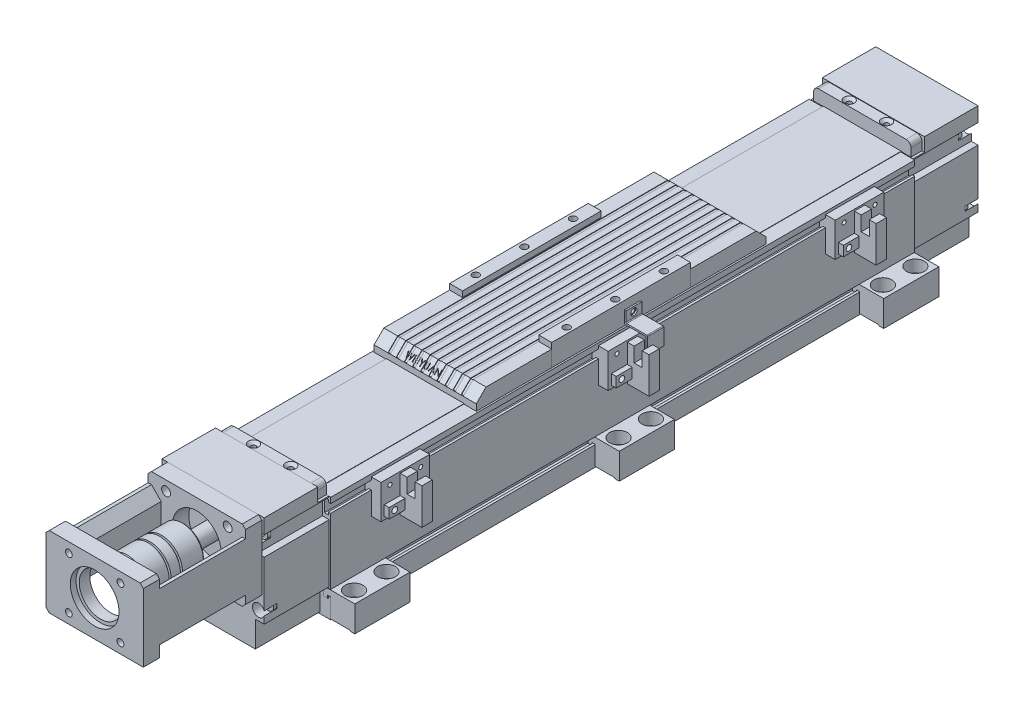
SolidWorks part; units mm, degrees
other "<光电感应片>-<切除-拉伸1>"
other "<EE-SX672672P>-<凸台-拉伸3>"
other "<EE-SX672672P>-<凸台-拉伸3>"
other "<EE-SX672672P>-<凸台-拉伸3>"
other "<MSX65B-50 100W松下伺服电机座>-<Ø5.5 (5.5) 直径孔1>"
ref_plane "前视基准面" through (0, 0, 0) normal (0, 0, 1) x (1, 0, 0)
ref_plane "上视基准面" through (0, 0, 0) normal (0, 1, 0) x (1, 0, 0)
ref_plane "右视基准面" through (0, 0, 0) normal (1, 0, 0) x (0, 0, -1)
sketch "草图1" plane through (0, 0, 0) normal (0, 0, 1) x (1, 0, 0)
  line L0 (-70.2256, 0) -> (70.2256, 0) construction
  line L1 (0, -59.1882) -> (0, 59.1882) construction
  line L2 (-32.5, -32.75) -> (-32.5, -20.65)
  line L3 (-32.5, 32.75) -> (-22.4, 32.75)
  line L4 (-32.5, -32.75) -> (32.5, -32.75)
  line L5 (32.5, 29.35) -> (32.5, 32.75)
  line L6 (-22.4, 32.75) -> (-22.4, 29.75)
  line L7 (-22.4, 29.75) -> (-19.4, 29.75)
  line L8 (-19.4, 29.75) -> (-19.4, 32.75)
  line L9 (-17.9, 26.75) -> (17.9, 26.75)
  line L11 (17.9, 32.75) -> (17.9, 26.75)
  line L12 (19.4, 32.75) -> (17.9, 32.75)
  line L13 (-19.4, 32.75) -> (-17.9, 32.75)
  line L14 (-17.9, 32.75) -> (-17.9, 26.75)
  line L18 (19.4, 29.75) -> (19.4, 32.75)
  line L19 (22.4, 29.75) -> (19.4, 29.75)
  line L20 (22.4, 32.75) -> (22.4, 29.75)
  line L21 (32.5, 32.75) -> (22.4, 32.75)
  line L22 (-32.5, -20.65) -> (-31, -20.65)
  line L23 (-31, -20.65) -> (-31, -22.15)
  line L24 (-31, -22.15) -> (-28, -22.15)
  line L25 (-28, -22.15) -> (-28, -14.95)
  line L26 (-28, -14.95) -> (-31, -14.95)
  line L27 (-32.5, 29.35) -> (-31, 29.35)
  line L28 (-31, 29.35) -> (-31, 30.85)
  line L29 (-31, 30.85) -> (-28.7, 30.85)
  line L30 (-28.7, 30.85) -> (-28.7, 22.65)
  line L31 (-28.7, 22.65) -> (-31, 22.65)
  line L32 (-32.5, -16.45) -> (-32.5, 24.15)
  line L33 (-32.5, 29.35) -> (-32.5, 32.75)
  line L34 (32.5, -16.45) -> (32.5, 24.15)
  line L35 (28.7, 26.75) -> (33.4434, 26.75) construction
  line L36 (32.5, 24.15) -> (31, 24.15)
  line L37 (31, 24.15) -> (31, 22.65)
  line L38 (28.7, 22.65) -> (31, 22.65)
  line L39 (28.7, 30.85) -> (28.7, 22.65)
  line L40 (28, -18.55) -> (34.4226, -18.55) construction
  line L41 (32.5, -16.45) -> (31, -16.45)
  line L42 (31, -16.45) -> (31, -14.95)
  line L43 (28, -14.95) -> (31, -14.95)
  line L44 (28, -22.15) -> (28, -14.95)
  line L45 (32.5, -32.75) -> (32.5, -20.65)
  line L50 (-28.7, 26.75) -> (-33.4434, 26.75) construction
  line L51 (-31, 24.15) -> (-31, 22.65)
  line L52 (-32.5, 24.15) -> (-31, 24.15)
  line L53 (31, 30.85) -> (28.7, 30.85)
  line L54 (31, 29.35) -> (31, 30.85)
  line L55 (32.5, 29.35) -> (31, 29.35)
  line L56 (-28, -18.55) -> (-34.4226, -18.55) construction
  line L57 (-31, -16.45) -> (-31, -14.95)
  line L58 (-32.5, -16.45) -> (-31, -16.45)
  line L59 (31, -22.15) -> (28, -22.15)
  line L60 (31, -20.65) -> (31, -22.15)
  line L61 (32.5, -20.65) -> (31, -20.65)
  circle A0 centre (-24.37, 26.75) radius 1.7
  circle A1 centre (-28, -9.75) radius 1.7
  circle A2 centre (24.37, 26.75) radius 1.7
  circle A3 centre (28, -9.75) radius 1.7
  point P6 (0, 0)
  point P9 (22.5, 0)
  point P11 (-22.5, 0)
  point P12 (0, -32.75)
  point P67 (20, 0)
  point P68 (-20, 0)
  dimension "D10" = 3.4
  dimension "D11" = 3.4
  dimension "D1" = 65
  dimension "D2" = 65.5
  dimension "D3" = 1.5
  dimension "D4" = 3
  dimension "D5" = 3
  dimension "D6" = 35.8
  dimension "D12" = 6
  dimension "D13" = 23
  dimension "D14" = 12.1
  dimension "D15" = 1.5
  dimension "D16" = 3
  dimension "D17" = 1.5
  dimension "D18" = 7.2
  dimension "D19" = 3.4
  dimension "D20" = 1.5
  dimension "D21" = 1.5
  dimension "D22" = 2.3
  dimension "D23" = 8.2
  dimension "D24" = 48.74
  dimension "D25" = 56
  dimension "D28" = 6
extrude "拉伸1" add sketch "草图1" along normal blind 360
sketch "草图2" plane through (0, 0, 360) normal (0, 0, 1) x (1, 0, 0)
  line L0 (-24.37, 26.75) -> (24.37, 26.75) construction
  line L1 (-28, -9.75) -> (28, -9.75) construction
  line L2 (0, 26.75) -> (0, 0) construction
  line L3 (-31.5, -15.55) -> (-26, -15.55)
  line L4 (31.5, 41.25) -> (-31.5, 41.25)
  line L5 (-31.5, 41.25) -> (-31.5, 32.25)
  line L6 (-31.5, 32.25) -> (-27.37, 32.25)
  line L7 (-27.37, 32.25) -> (-27.37, 20.25)
  line L8 (-27.37, 20.25) -> (-31.5, 20.25)
  line L9 (-31.5, 20.25) -> (-31.5, -15.55)
  line L10 (-26, -15.55) -> (-26, -31.55)
  line L11 (26, -15.55) -> (26, -31.55)
  line L12 (31.5, -15.55) -> (26, -15.55)
  line L13 (-26, -31.55) -> (26, -31.55)
  line L18 (31.5, 20.25) -> (31.5, -15.55)
  line L19 (27.37, 20.25) -> (31.5, 20.25)
  line L20 (27.37, 32.25) -> (27.37, 20.25)
  line L21 (31.5, 32.25) -> (27.37, 32.25)
  line L22 (31.5, 41.25) -> (31.5, 32.25)
  circle A0 centre (-24.37, 26.75) radius 1.7
  circle A1 centre (-28, -9.75) radius 1.7
  circle A2 centre (24.37, 26.75) radius 1.7
  circle A3 centre (28, -9.75) radius 1.7
  point P18 (0, -21.8)
  dimension "D1" = 5.8
  dimension "D3" = 63
  dimension "D4" = 3
  dimension "D5" = 52
  dimension "D7" = 9
  dimension "D8" = 12
  dimension "D2" = 72.8
extrude "拉伸2" add sketch "草图2" along normal blind 40
sketch "草图3" plane through (0, 0, 400) normal (0, 0, 1) x (1, 0, 0)
  line L0 (0, 0) -> (0, 30.1742) construction
  circle A0 centre (-24.37, 26.75) radius 3.75
  circle A1 centre (-28, -9.75) radius 3.75
  circle A2 centre (24.37, 26.75) radius 3.75
  circle A3 centre (28, -9.75) radius 3.75
  dimension "D1" = 7.5
  dimension "D2" = 7.5
extrude "拉伸3" cut sketch "草图3" against normal blind 8
sketch "草图5" plane through (0, 0, 392) normal (0, 0, 1) x (1, 0, 0)
  line L0 (0, 0) -> (0, 9.7659) construction
  line L1 (28.866, -8.25) -> (29.7321, -9.75)
  line L2 (-22.6379, 26.75) -> (-23.504, 28.25)
  line L3 (-23.504, 28.25) -> (-25.236, 28.25)
  line L4 (-25.236, 28.25) -> (-26.1021, 26.75)
  line L5 (-26.1021, 26.75) -> (-25.236, 25.25)
  line L6 (-25.236, 25.25) -> (-23.504, 25.25)
  line L7 (-23.504, 25.25) -> (-22.6379, 26.75)
  line L8 (-29.7321, -9.75) -> (-28.866, -11.25)
  line L9 (-28.866, -11.25) -> (-27.134, -11.25)
  line L10 (-27.134, -11.25) -> (-26.2679, -9.75)
  line L11 (-26.2679, -9.75) -> (-27.134, -8.25)
  line L12 (-27.134, -8.25) -> (-28.866, -8.25)
  line L13 (-28.866, -8.25) -> (-29.7321, -9.75)
  line L14 (27.134, -8.25) -> (28.866, -8.25)
  line L15 (26.2679, -9.75) -> (27.134, -8.25)
  line L16 (27.134, -11.25) -> (26.2679, -9.75)
  line L17 (28.866, -11.25) -> (27.134, -11.25)
  line L18 (29.7321, -9.75) -> (28.866, -11.25)
  line L19 (23.504, 25.25) -> (22.6379, 26.75)
  line L20 (25.236, 25.25) -> (23.504, 25.25)
  line L21 (26.1021, 26.75) -> (25.236, 25.25)
  line L22 (25.236, 28.25) -> (26.1021, 26.75)
  line L23 (23.504, 28.25) -> (25.236, 28.25)
  line L24 (22.6379, 26.75) -> (23.504, 28.25)
  circle A0 centre (-24.37, 26.75) radius 3.25
  circle A1 centre (-24.37, 26.75) radius 1.5 construction
  circle A2 centre (-28, -9.75) radius 3.25
  circle A3 centre (-28, -9.75) radius 1.5 construction
  circle A4 centre (28, -9.75) radius 1.5 construction
  circle A5 centre (24.37, 26.75) radius 1.5 construction
  circle A6 centre (28, -9.75) radius 3.25
  circle A7 centre (24.37, 26.75) radius 3.25
  dimension "D1" = 6.5
  dimension "D2" = 3
  dimension "D3" = 6.5
  dimension "D4" = 3
extrude "拉伸4" add sketch "草图5" along normal blind 2
sketch "草图6" plane through (0, 41.25, 0) normal (0, 1, 0) x (1, 0, 0)
  line L0 (31.5, -400) -> (31.5, -360) construction
  line L1 (-31.5, -360) -> (31.5, -360)
  line L2 (-31.5, -360) -> (-31.5, -367)
  line L3 (-31.5, -367) -> (31.5, -367)
  line L4 (31.5, -360) -> (31.5, -367)
  dimension "D1" = 7
extrude "拉伸5" cut sketch "草图6" against normal blind 8.3
sketch "草图7" plane through (0, -32.75, 0) normal (0, -1, 0) x (1, 0, 0)
  line L0 (0, 0) -> (0, 360) construction
  line L1 (-32.5, 360) -> (32.5, 360) construction
  point P5 (0, 180)
ref_plane "基准面1" through (0, 0, 180) normal (0, 0, 1) x (1, 0, 0)
mirror "镜向2" about plane through (0, 0, 180) normal (0, 0, 1)
sketch "草图8" plane through (0, 32.95, 0) normal (0, 1, 0) x (1, 0, 0)
  line L0 (0, 7) -> (0, -8.336) construction
  line L1 (-31.5, 7) -> (31.5, 7) construction
  line L2 (-24, 7) -> (-24, -367)
  line L3 (-31.5, -367) -> (31.5, -367) construction
  line L4 (24, 7) -> (24, -367)
  line L5 (-24, 7) -> (24, 7)
  line L6 (-24, -367) -> (24, -367)
  dimension "D1" = 48
extrude "拉伸6" add sketch "草图8" along normal blind 0.2
sketch "草图9" plane through (0, 32.95, 0) normal (0, 1, 0) x (1, 0, 0)
  line L0 (0, 0) -> (0, 7) construction
  line L1 (32.5, 0) -> (31.5, 0) construction
  line L2 (-31.5, 7) -> (31.5, 7) construction
  line L4 (-30, 7) -> (-30, 0.2)
  line L6 (-30, 0.2) -> (30, 0.2)
  line L7 (-30, 7) -> (30, 7)
  line L9 (30, 7) -> (30, 0.2)
  dimension "D1" = 60
  dimension "D2" = 0.2
extrude "拉伸7" add sketch "草图9" along normal blind 8
sketch "草图10" plane through (0, 40.95, 0) normal (0, 1, 0) x (1, 0, 0)
  line L0 (0, 7) -> (0, 0.2) construction
  line L1 (-31.5, 7) -> (31.5, 7) construction
  line L2 (-30, 0.2) -> (30, 0.2) construction
  line L3 (-30, 3.6) -> (30, 3.6) construction
  line L4 (-30, 7) -> (-30, 0.2) construction
  line L5 (30, 0.2) -> (30, 7) construction
  line L6 (-11.5, 3.6) -> (-11.5, 5.6128) construction
  line L7 (11.5, 3.6) -> (11.5, 5.6128) construction
  dimension "D1" = 23
hole_wizard "打孔尺寸根据十字槽沉头自攻螺钉的类型1" positions "3D草图1" profile "草图11" countersink size "ST2.9" standard "GB"
sketch3d "3D草图1"
  point P0 (-11.5, 40.95, -3.6)
  point P3 (11.5, 40.95, -3.6)
sketch "草图11" plane through (-11.5, 40.95, -3.6) normal (1, 0, 0) x (0, 0, 1)
  line L0 (0, 0) -> (0, 8.9313)
  line L1 (0, 8.9313) -> (1.55, 8)
  line L2 (1.55, 8) -> (1.55, 1.6)
  line L3 (1.55, 1.6) -> (3.15, 0)
  line L5 (3.15, 0) -> (0, 0)
  line L6 (-1.55, 1.6) -> (-3.15, 0) construction
  line L10 (0, 8.9313) -> (-1.55, 8) construction
  line L11 (0, -6.35) -> (0, 107.95) construction
  dimension "孔直径" = 3.1
  dimension "孔深度" = 8
  dimension "近端锥形沉头孔直径" = 6.3
  dimension "近端锥形沉头孔角度" = 90
  dimension "导头角度" = 118
mirror "镜向3" about plane through (0, 0, 180) normal (0, 0, 1)
sketch "草图12" plane through (0, 0, 400) normal (0, 0, 1) x (1, 0, 0)
  line L0 (0, 41.25) -> (0, -31.55) construction
  line L1 (31.5, 41.25) -> (-31.5, 41.25) construction
  line L3 (19, 35.25) -> (-19, 35.25) construction
  line L4 (19, 19.25) -> (-19, 19.25) construction
  line L5 (-26, -31.55) -> (26, -31.55) construction
  circle A0 centre (-19, 35.25) radius 2
  circle A1 centre (19, 35.25) radius 2
  circle A2 centre (19, 3.25) radius 2
  circle A3 centre (-19, 3.25) radius 2
  point P9 (0, 35.25)
  dimension "D4" = 4
  dimension "D1" = 6
  dimension "D2" = 38
extrude "拉伸8" cut sketch "草图12" against normal blind 8
sketch "草图13" plane through (0, 0, 400) normal (0, 0, 1) x (1, 0, 0)
  line L0 (-19, 35.25) -> (19, 35.25) construction
  line L1 (-19, 35.25) -> (-19, 3.25) construction
  line L2 (-19, 3.25) -> (19, 3.25) construction
  line L3 (19, 3.25) -> (19, 35.25) construction
  line L4 (0, 35.25) -> (0, 3.25) construction
  line L5 (-19, 19.25) -> (19, 19.25) construction
  line L6 (-28.5, 39.25) -> (-28.5, -4.75)
  line L7 (28.5, 39.25) -> (28.5, -4.75)
  line L8 (-28.5, 39.25) -> (28.5, 39.25)
  line L9 (-28.5, -4.75) -> (28.5, -4.75)
  circle A0 centre (-19, 35.25) radius 2
  circle A1 centre (19, 35.25) radius 2
  circle A2 centre (19, 3.25) radius 2
  circle A3 centre (-19, 3.25) radius 2
  dimension "D1" = 57
  dimension "D2" = 4
  dimension "D3" = 44
sketch "草图23" plane through (0, 32.75, 0) normal (0, 1, 0) x (1, 0, 0)
  line L0 (-32.5, -180) -> (32.5, -180) construction
  line L1 (-32.5, -360) -> (-32.5, 0) construction
  line L2 (32.5, -360) -> (32.5, 0) construction
  line L3 (0, -360.2) -> (0, 0.2) construction
  line L4 (-30, -360.2) -> (30, -360.2) construction
  line L5 (-30, 0.2) -> (30, 0.2) construction
  line L6 (-31.5, -222.75) -> (-31.5, -137.25)
  line L7 (-31.5, -137.25) -> (-23.5, -137.25)
  line L8 (-31.5, -222.75) -> (-23.5, -222.75)
  line L9 (31.5, -222.75) -> (31.5, -137.25)
  line L10 (-23.5, -137.25) -> (-23.5, -222.75)
  line L11 (23.5, -137.25) -> (23.5, -222.75)
  line L12 (23.5, -137.25) -> (31.5, -137.25)
  line L13 (23.5, -222.75) -> (31.5, -222.75)
  point P15 (31.5, -180)
  point P17 (-31.5, -180)
  point P18 (0, -232.75)
  point P19 (0, -127.25)
  dimension "D1" = 85.5
  dimension "D2" = 63
  dimension "D3" = 8
extrude "拉伸18" add sketch "草图23" along normal blind 14.5
sketch "草图29" plane through (0, 47.25, 0) normal (0, 1, 0) x (1, 0, 0)
  line L0 (-27.5, -137.25) -> (-27.5, -222.75) construction
  line L1 (-23.5, -137.25) -> (-31.5, -137.25) construction
  line L2 (-31.5, -222.75) -> (-23.5, -222.75) construction
  line L3 (-39.5, -137.25) -> (-39.5, -222.75)
  line L4 (-15.5, -137.25) -> (-15.5, -222.75)
  line L5 (-39.5, -137.25) -> (-15.5, -137.25)
  line L6 (-39.5, -222.75) -> (-15.5, -222.75)
  line L8 (10.7078, -137.25) -> (47.7585, -137.25)
  line L9 (10.7078, -137.25) -> (10.7078, -222.75)
  line L10 (10.7078, -222.75) -> (47.7585, -222.75)
  line L11 (47.7585, -137.25) -> (47.7585, -222.75)
  dimension "D1" = 24
extrude "拉伸22" cut sketch "草图29" against normal blind 1
sketch "草图30" plane through (0, 46.25, 0) normal (0, 1, 0) x (-1, 0, 0)
  line L0 (0, 0) -> (0, 360.2) construction
  line L1 (24, 360.2) -> (-24, 360.2) construction
  line L2 (28, 150.1) -> (28, 210.1) construction
  line L5 (28, 180.1) -> (0, 180.1) construction
  line L6 (-28, 150.1) -> (-28, 210.1) construction
  line L7 (0, 180.1) -> (-28, 180.1) construction
  dimension "D1" = 56
  dimension "D2" = 60
hole_wizard "M5 螺纹孔1" positions "3D草图3" profile "草图31" tap size "M5" standard "ISO"
sketch3d "3D草图3"
  point P0 (-28, 46.25, 150.1)
  point P3 (-28, 46.25, 180.1)
  point P6 (-28, 46.25, 210.1)
  point P9 (28, 46.25, 210.1)
  point P12 (28, 46.25, 180.1)
  point P15 (28, 46.25, 150.1)
sketch "草图31" plane through (-28, 46.25, 150.1) normal (1, 0, 0) x (0, 0, 1)
  line L0 (0, 0) -> (0, 13.6618)
  line L1 (0, 13.6618) -> (2.1, 12.4)
  line L2 (2.1, 12.4) -> (2.1, 0)
  line L5 (2.1, 0) -> (0, 0)
  line L10 (0, 13.6618) -> (-2.1, 12.4) construction
  line L11 (0, -6.35) -> (0, 107.95) construction
  dimension "螺纹孔钻头直径" = 4.2
  dimension "螺纹孔钻头深度" = 12.4
  dimension "导头角度" = 118
sketch "草图32" plane through (0, 0, 360) normal (0, 0, 1) x (1, 0, 0)
  line L0 (-32.5, -32.75) -> (32.5, -32.75) construction
  line L3 (-15, -32.75) -> (15, -32.75)
  line L4 (-15, -32.75) -> (-15, -31.75)
  line L5 (-15, -31.75) -> (15, -31.75)
  line L6 (15, -32.75) -> (15, -31.75)
  line L7 (0, -31.55) -> (0, -32.75) construction
  line L8 (-26, -31.55) -> (26, -31.55) construction
  dimension "D1" = 30
  dimension "D2" = 1
extrude "切除-拉伸1" cut sketch "草图32" against normal through all
chamfer "倒角1" distance 1 angle 45 2 edges at (15, -32.75, 180) (-15, -32.75, 180)
sketch "草图33" plane through (0, 32.75, 0) normal (0, 1, 0) x (1, 0, 0)
  line L0 (-31.5, -137.25) -> (-31.5, -90.75)
  line L1 (-31.5, -90.75) -> (31.5, -90.75)
  line L2 (0, -90.75) -> (0, 0) construction
  line L3 (-23.5, -180) -> (23.5, -180) construction
  line L4 (-23.5, -137.25) -> (-23.5, -222.75) construction
  line L5 (23.5, -137.25) -> (23.5, -222.75) construction
  line L6 (-31.5, -137.25) -> (-23.5, -137.25)
  line L7 (-23.5, -137.25) -> (-23.5, -222.75)
  line L8 (23.5, -137.25) -> (23.5, -222.75)
  line L9 (31.5, -137.25) -> (23.5, -137.25)
  line L10 (31.5, -137.25) -> (31.5, -90.75)
  line L11 (-31.5, -137.25) -> (-31.5, -90.75)
  line L12 (-31.5, -137.25) -> (-23.5, -137.25)
  line L13 (-23.5, -137.25) -> (-23.5, -222.75)
  line L14 (23.5, -137.25) -> (23.5, -222.75)
  line L15 (31.5, -137.25) -> (23.5, -137.25)
  line L16 (31.5, -137.25) -> (31.5, -90.75)
  line L17 (0, -269.25) -> (0, -360) construction
  line L18 (31.5, -222.75) -> (31.5, -269.25)
  line L19 (31.5, -222.75) -> (23.5, -222.75)
  line L20 (-31.5, -222.75) -> (-23.5, -222.75)
  line L21 (-31.5, -222.75) -> (-31.5, -269.25)
  line L22 (31.5, -222.75) -> (31.5, -269.25)
  line L23 (31.5, -222.75) -> (23.5, -222.75)
  line L24 (-31.5, -222.75) -> (-23.5, -222.75)
  line L25 (-31.5, -269.25) -> (31.5, -269.25)
  line L26 (-31.5, -222.75) -> (-31.5, -269.25)
  dimension "D1" = 178.5
extrude "凸台-拉伸2" add sketch "草图33" along normal blind 10 separate body contours L25 L18 L19 L8 L9 L10 L1 M6 | L21 L25 L1 L0 M6 M7 M8 M9
chamfer "倒角2" distance 6 angle 45 2 edges at (0, 42.75, 90.75) (0, 42.75, 269.25)
sketch "草图34" plane through (0, 0, 400) normal (0, 0, 1) x (1, 0, 0)
  line L0 (0, 19.25) -> (0, 0) construction
  line L1 (-32.5, -32.75) -> (-16, -32.75) construction
  circle A0 centre (0, 19.25) radius 5
  dimension "D1" = 10
  dimension "D2" = 52
extrude "凸台-拉伸3" add sketch "草图34" along normal blind 30
sketch "草图35" plane through (0, 153, 153) normal (0, 0.7071, 0.7071) x (1, 0, 0)
  text T0 "WEIYUAN"
extrude "切除-拉伸2" cut sketch "草图35" against normal blind 0.5
ref_plane "基准面2" through (22, 0, 0) normal (-1, 0, 0) x (0, 0, 1)
sketch "草图37" plane through (22, 0, 0) normal (-1, 0, 0) x (0, 0, 1)
  line L0 (90.75, 36.75) -> (96.75, 42.75)
  line L1 (96.75, 42.75) -> (263.25, 42.75)
  line L2 (263.25, 42.75) -> (269.25, 36.75)
  line L3 (91.1743, 36.75) -> (96.8743, 42.45)
  line L4 (96.8743, 42.45) -> (263.1257, 42.45)
  line L5 (263.1257, 42.45) -> (268.8257, 36.75)
  line L6 (269.25, 36.75) -> (268.8257, 36.75)
  line L7 (90.75, 36.75) -> (91.1743, 36.75)
  line L9 (90.9621, 36.5379) -> (96.8743, 42.45) construction
  line L10 (263.1257, 42.45) -> (269.0379, 36.5379) construction
  dimension "D1" = 0.3
extrude "切除-拉伸3" cut sketch "草图37" against normal blind 1.5
pattern_linear "阵列(线性)1" count 10 spacing 5 along (-1, 0, 0) of "切除-拉伸3"
sketch "草图38" plane through (0, 0, 360) normal (0, 0, 1) x (1, 0, 0)
  line L0 (30.6, -22.25) -> (28, -22.25)
  line L1 (32.5, -20.44) -> (30.6, -20.44)
  line L2 (30, -16.75) -> (47.3821, -16.75)
  line L3 (28, -18.75) -> (30, -16.75)
  line L4 (28, -22.25) -> (28, -18.75)
  line L5 (30.6, -20.44) -> (30.6, -22.25)
  line L6 (32.5, -32.25) -> (32.5, -20.44)
  line L7 (47.3821, -32.75) -> (47.3821, -16.75)
  line L8 (44.3821, -32.75) -> (44.3821, -32.25)
  line L9 (44.3821, -32.75) -> (47.3821, -32.75)
  line L10 (32.5, -32.25) -> (44.3821, -32.25)
  line L11 (16, -32.75) -> (32.5, -32.75) construction
  line L12 (32.5, -32.75) -> (32.5, -20.65) construction
  line L13 (0, -31.75) -> (0, 0) construction
  line L14 (15, -31.75) -> (-15, -31.75) construction
  line L15 (-32.5, -32.25) -> (-44.3821, -32.25)
  line L16 (-44.3821, -32.75) -> (-47.3821, -32.75)
  line L17 (-44.3821, -32.75) -> (-44.3821, -32.25)
  line L18 (-47.3821, -32.75) -> (-47.3821, -16.75)
  line L19 (-32.5, -32.25) -> (-32.5, -20.44)
  line L20 (-30.6, -20.44) -> (-30.6, -22.25)
  line L21 (-28, -22.25) -> (-28, -18.75)
  line L22 (-28, -18.75) -> (-30, -16.75)
  line L23 (-30, -16.75) -> (-47.3821, -16.75)
  line L24 (-32.5, -20.44) -> (-30.6, -20.44)
  line L25 (-30.6, -22.25) -> (-28, -22.25)
extrude "凸台-拉伸4" add sketch "草图38" against normal blind 34 separate body
hole_wizard "打孔尺寸根据六角头螺栓全螺纹 C 级的类型1" positions "草图40" profile "草图39" counterbore size "M5" standard "Gb"
sketch "草图40" plane through (0, -16.75, 0) normal (0, 1, 0) x (1, 0, 0)
  line L0 (47.3821, -343) -> (-47.3821, -343) construction
  line L1 (47.3821, -326) -> (47.3821, -360) construction
  line L2 (-47.3821, -326) -> (-47.3821, -360) construction
  point P0 (39.8821, -333)
  point P2 (39.8821, -353)
  point P4 (-39.8821, -333)
  point P6 (-39.8821, -353)
  dimension "D1" = 20
  dimension "D2" = 7.5
  dimension "D3" = 7.5
sketch "草图39" plane through (39.8821, -16.75, 333) normal (1, 0, 0) x (0, 0, 1)
  line L0 (0, 0) -> (0, 16)
  line L1 (0, 16) -> (3.25, 16)
  line L3 (3.25, 16) -> (3.25, 7.5)
  line L4 (3.25, 7.5) -> (5.5, 7.5)
  line L5 (5.5, 7.5) -> (5.5, 0)
  line L7 (5.5, 0) -> (0, 0)
  line L11 (0, -6.35) -> (0, 107.95) construction
  dimension "通孔孔直径" = 6.5
  dimension "通孔孔深度" = 16
  dimension "柱形沉头孔直径" = 11
  dimension "柱形沉头孔深度" = 7.5
pattern_linear "阵列(线性)2" count 3 spacing 163 along (0, 0, -1) of "凸台-拉伸4", "打孔尺寸根据六角头螺栓全螺纹 C 级的类型1"
hole_wizard "M3 螺纹孔1" positions "草图42" profile "草图41" tap size "M3" standard "Gb"
sketch "草图42" plane through (31.5, 0, 0) normal (1, 0, 0) x (0, 0, -1)
  line L0 (-137.25, 46.25) -> (-137.25, 32.75) construction
  line L1 (-222.75, 32.75) -> (-137.25, 32.75) construction
  point P0 (-173.05, 38.25)
  dimension "D1" = 35.8
  dimension "D2" = 5.5
sketch "草图41" plane through (31.5, 38.25, 173.05) normal (0, 1, 0) x (0, 0, -1)
  line L0 (0, 0) -> (0, 9.2511)
  line L1 (0, 9.2511) -> (1.25, 8.5)
  line L2 (1.25, 8.5) -> (1.25, 0)
  line L5 (1.25, 0) -> (0, 0)
  line L10 (0, 9.2511) -> (-1.25, 8.5) construction
  line L11 (0, -6.35) -> (0, 107.95) construction
  dimension "螺纹孔钻头直径" = 2.5
  dimension "螺纹孔钻头深度" = 8.5
  dimension "导头角度" = 118
mirror "镜向7" about plane through (0, 0, 0) normal (1, 0, 0) of "M3 螺纹孔1"
ref_plane "基准面4" through (0, 0, 180) normal (0, 0, 1) x (1, 0, 0)
sketch "草图43" plane through (0, 0, 180) normal (0, 0, 1) x (1, 0, 0)
  line L0 (-3.2812, 40.498) -> (0, 0) construction
  line L16 (32.5, 29.35) -> (32.5, 32.75) construction
  line B0 (38.5, 10.15) -> (32.5, 10.15)
  line B1 (29.2, 29.55) -> (30.8, 29.55)
  line B2 (29.2, 24.35) -> (30.8, 24.35)
  line B3 (30.8, 25.25) -> (32.5, 25.25)
  line B4 (30.8, 28.65) -> (32.5, 28.65)
  line B5 (32.5, 31.15) -> (32.5, 28.65)
  line B6 (30.8, 29.55) -> (30.8, 28.65)
  line B7 (30.8, 25.25) -> (30.8, 24.35)
  line B8 (29.2, 29.55) -> (29.2, 24.35)
  line B9 (38.5, 10.15) -> (38.5, 31.15)
  line B10 (32.5, 31.15) -> (38.5, 31.15)
  line B11 (32.5004, 18.4) -> (33.0409, 18.4)
  line B12 (32.5004, 15.5) -> (33.0409, 15.5)
  line B13 (32.5, 25.25) -> (32.5, 18.4)
  line B14 (32.5, 10.15) -> (32.5, 15.5)
  arc B15 (33.0409, 15.5) -> (33.0409, 18.4) centre (34.56, 16.95) ccw
  line B16 (-39.6318, 3.8197) -> (-33.7101, 4.7856)
  line B17 (-33.5763, 24.4638) -> (-35.1554, 24.2062)
  line B18 (-32.7391, 19.3316) -> (-34.3183, 19.0741)
  line B19 (-34.4631, 19.9623) -> (-36.141, 19.6886)
  line B20 (-35.0105, 23.318) -> (-36.6883, 23.0443)
  line B21 (-37.0908, 25.5117) -> (-36.6883, 23.0443)
  line B22 (-35.1554, 24.2062) -> (-35.0105, 23.318)
  line B23 (-34.4631, 19.9623) -> (-34.3183, 19.0741)
  line B24 (-33.5763, 24.4638) -> (-32.7391, 19.3316)
  line B25 (-39.6318, 3.8197) -> (-43.0125, 24.5458)
  line B26 (-37.0908, 25.5117) -> (-43.0125, 24.5458)
  line B27 (-35.0387, 12.9279) -> (-35.5721, 12.8409)
  line B28 (-34.5718, 10.0657) -> (-35.1052, 9.9787)
  line B29 (-36.141, 19.6886) -> (-35.0382, 12.928)
  line B30 (-33.7101, 4.7856) -> (-34.5714, 10.0658)
  arc B31 (-35.1052, 9.9787) -> (-35.5721, 12.8409) centre (-36.8379, 11.1653) cw
sketch_block_instance "块1-1"
sketch_block "块1"
sketch_block_instance "块1-2"
extrude "拉伸-薄壁1" add sketch "草图43" along normal mid plane 30 thin contours B9
hole_wizard "M3 螺纹孔2" positions "草图45" profile "草图44" tap size "M3" standard "Gb"
sketch "草图45" plane through (38.5, 0, 0) normal (1, 0, 0) x (0, 0, -1)
  line L0 (-195, 31.15) -> (-165, 31.15) construction
  line L1 (-180, 31.15) -> (-180, 10.15) construction
  line L2 (-195, 10.15) -> (-165, 10.15) construction
  line L3 (-180, 31.15) -> (-180, 10.15) construction
  point P0 (-189.5, 27.15)
  point P2 (-170.5, 27.15)
  point P4 (-170.5, 15.15)
  point P6 (-189.5, 15.15)
  dimension "D1" = 4
  dimension "D2" = 12
  dimension "D3" = 19
sketch "草图44" plane through (38.5, 27.15, 189.5) normal (0, 1, 0) x (0, 0, -1)
  line L0 (0, 0) -> (0, 9.2511)
  line L1 (0, 9.2511) -> (1.25, 8.5)
  line L2 (1.25, 8.5) -> (1.25, 0)
  line L5 (1.25, 0) -> (0, 0)
  line L10 (0, 9.2511) -> (-1.25, 8.5) construction
  line L11 (0, -6.35) -> (0, 107.95) construction
  dimension "螺纹孔钻头直径" = 2.5
  dimension "螺纹孔钻头深度" = 8.5
  dimension "导头角度" = 118
inserted part "光电感应片"
move or copy body "实体-移动/复制2" placed by mates yes
pattern_linear "阵列(线性)5" count 2 spacing 140 along (0, 0, 1) count 2 spacing 140 along (0, 0, -1) of "拉伸-薄壁1", "M3 螺纹孔2"
inserted part "EE-SX672672P"
move or copy body "实体-移动/复制6" placed by mates yes
inserted part "EE-SX672672P4"
move or copy body "实体-移动/复制8" placed by mates yes
inserted part "EE-SX672672P5"
move or copy body "实体-移动/复制10" placed by mates yes
inserted part "MSX65B-50 100W松下伺服电机座"
move or copy body "实体-移动/复制18" placed by mates yes
ref_plane "基准面18" through (0, 0, 418) normal (0, 0, 1) x (1, 0, 0)
sketch "草图58" plane through (0, 0, 418) normal (0, 0, 1) x (1, 0, 0)
  circle A0 centre (0, 19.25) radius 13
  circle A1 centre (0, 19.25) radius 5
  dimension "D1" = 26
extrude "凸台-拉伸5" add sketch "草图58" along normal blind 36
sketch "草图59" plane through (0, 0, 0) normal (1, 0, 0) x (0, 0, -1)
  line L0 (-436, 32.25) -> (-436, 6.25) construction
  line L1 (-440.1, 33.7006) -> (-438.9, 33.7006)
  line L2 (-440.1, 33.7006) -> (-440.1, 30.75)
  line L3 (-440.1, 30.75) -> (-438.9, 30.75)
  line L4 (-438.9, 33.7006) -> (-438.9, 30.75)
  line L5 (-433.1, 34.9342) -> (-431.9, 34.9342)
  line L6 (-433.1, 34.9342) -> (-433.1, 30.75)
  line L7 (-433.1, 30.75) -> (-431.9, 30.75)
  line L8 (-431.9, 34.9342) -> (-431.9, 30.75)
  line L9 (-418, 32.25) -> (-454, 32.25) construction
  line L10 (-454, 6.25) -> (-418, 6.25) construction
  dimension "D1" = 5.8
  dimension "D2" = 1.2
  dimension "D3" = 1.2
  dimension "D4" = 1.5
revolve "切除-旋转1" cut sketch "草图59" angle 360 about axis through (0, 19.25, 454) along (0, 0, -1)
chamfer "倒角3" distance 1 angle 45 2 edges at (13, 19.25, 418) (13, 19.25, 454)
sketch "草图60" plane through (0, 0, 454) normal (0, 0, 1) x (1, 0, 0)
  circle A0 centre (0, 19.25) radius 5
  circle A1 centre (0, 19.25) radius 4
  circle A2 centre (0, 19.25) radius 5 construction
  dimension "D1" = 8
extrude "凸台-拉伸6" add sketch "草图60" against normal blind 15
chamfer "倒角4" distance 2 angle 45 10 edges at (30, 41.25, 468) (30, 41.25, 405) (-30, 41.25, 468) (-30, 41.25, 405) (-30, -2.75, 468) (-30, -2.75, 405) (30, -2.75, 405)
fillet "圆角1" radius 3 4 edges at (30, 40.95, 363.6) (-30, 40.95, 363.6) (-30, 40.95, -3.6) (30, 40.95, -3.6)
